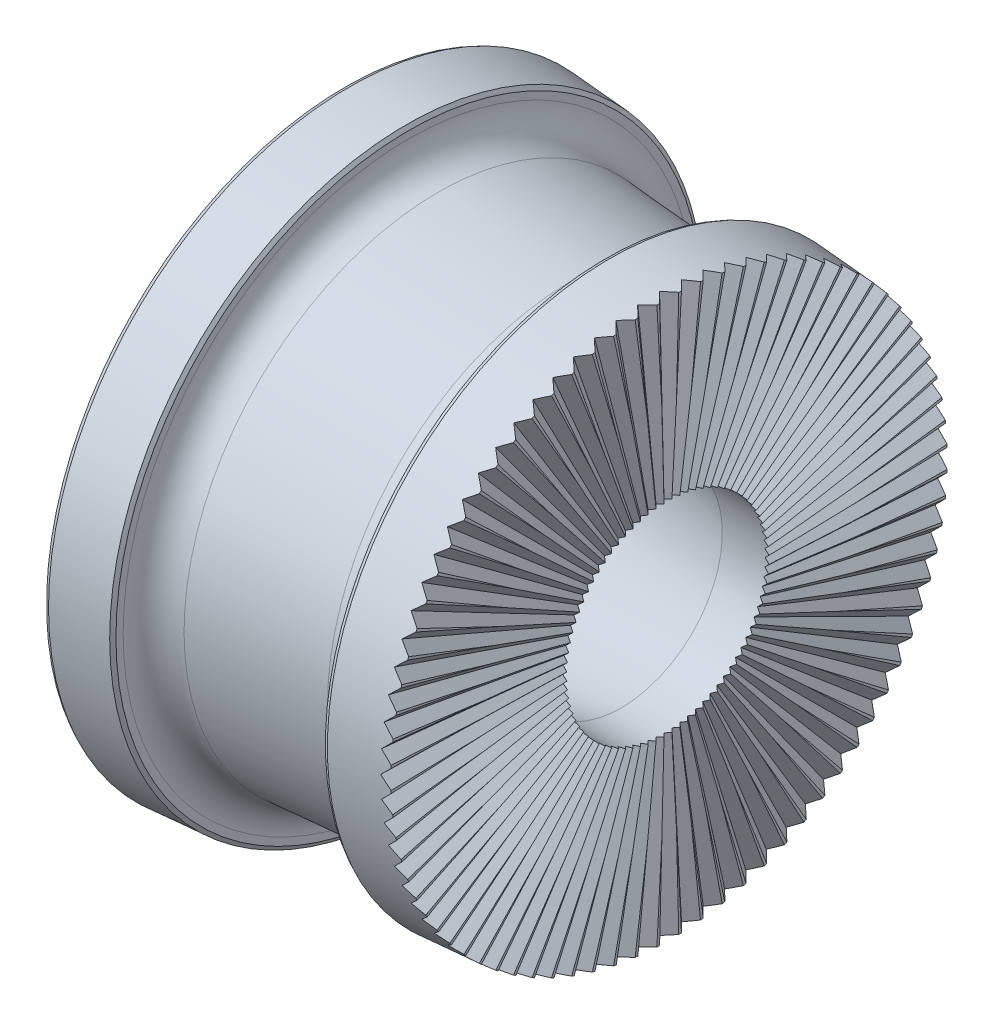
SolidWorks part; units mm, degrees
ref_plane "Front Plane" through (0, 0, 0) normal (0, 0, 1) x (1, 0, 0)
ref_plane "Top Plane" through (0, 0, 0) normal (0, 1, 0) x (1, 0, 0)
ref_plane "Right Plane" through (0, 0, 0) normal (1, 0, 0) x (0, 0, -1)
sketch "Sketch1" plane through (0, 0, 0) normal (0, 0, 1) x (1, 0, 0)
  line L0 (0, 0) -> (12.8, 0) construction
  line L1 (10.9, 4) -> (12.8, 4)
  line L2 (12.8, 4) -> (12.8, 11)
  line L3 (12.8, 11) -> (10.3, 11.1758)
  line L4 (0, 11.9) -> (0, 5.922)
  line L5 (10.9, 4) -> (0, 5.922)
  line L6 (2.5, 11.7242) -> (2.5, 11.2894)
  line L7 (3.6623, 10.0425) -> (8.9623, 9.6698)
  line L8 (10.3, 10.9168) -> (10.3, 11.1758)
  line L9 (2.5, 11.7242) -> (0, 11.9)
  arc A0 (8.9623, 9.6698) -> (10.3, 10.9168) centre (9.05, 10.9168) ccw
  arc A1 (2.5, 11.2894) -> (3.6623, 10.0425) centre (3.75, 11.2894) ccw
  point P16 (2.5, 10.1242)
  dimension "D7" = 1.25
  dimension "D1" = 10
  dimension "D2" = 4
  dimension "D3" = 11
  dimension "D4" = 11.9
  dimension "D5" = 1.9
  dimension "D6" = 1.6
  dimension "D8" = 2.5
  dimension "D9" = 2.5
  dimension "D10" = 12.8
revolve "Revolve1" add sketch "Sketch1" angle 360 about L0
sketch "Sketch2" plane through (0, 0, 0) normal (0, 0, 1) x (1, 0, 0)
  line L0 (0, 0) -> (12.8, 0) construction
  line L1 (12.8, -11) -> (12.8, 11) construction
  line L3 (12.8, 0.206) -> (12.8, -0.206) construction
  line L4 (12.6929, 0) -> (12.8989, 0.206)
  line L7 (12.8989, 0.206) -> (12.8989, 0)
  line L8 (12.8989, 0) -> (12.8989, -0.206)
  line L9 (12.6929, 0) -> (12.8989, -0.206)
extrude "Cut-Extrude1" cut sketch "Sketch2" against normal blind 12 draft 1
pattern_circular "CirPattern1" count 80 over 360 about axis through (0, 0, 0) along (1, 0, 0) of "Cut-Extrude1"
chamfer "Chamfer1" distance 0.15 angle 30 4 edges at (2.5, 0, 11.7242) (0, 0, 11.9) (10.3, 0, 11.1758) (0, 0, 5.922)
